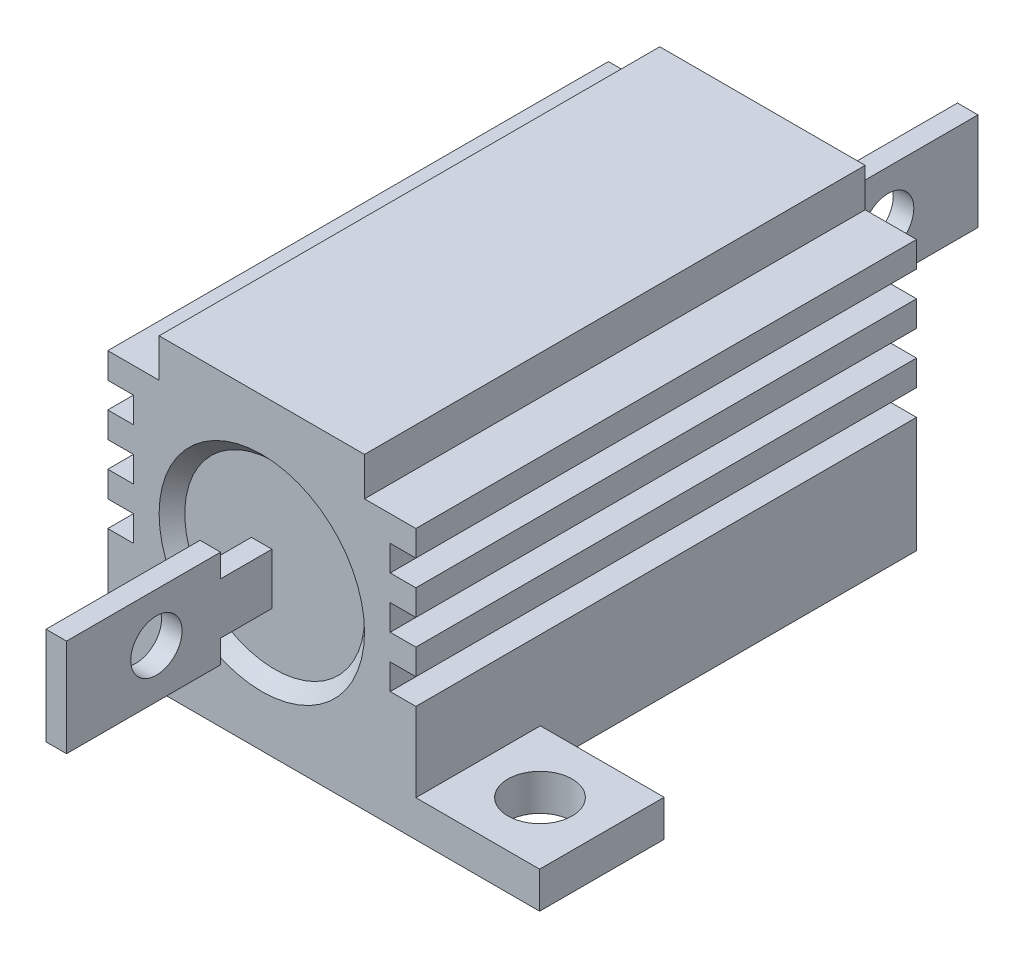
SolidWorks part; units mm, degrees
ref_plane "Plan de face" through (0, 0, 0) normal (0, 0, 1) x (1, 0, 0)
ref_plane "Plan de dessus" through (0, 0, 0) normal (0, 1, 0) x (1, 0, 0)
ref_plane "Plan de droite" through (0, 0, 0) normal (1, 0, 0) x (0, 0, -1)
sketch "Esquisse1" plane through (0, 0, 0) normal (0, 0, 1) x (1, 0, 0)
  line L0 (-10.4943, 0) -> (-22.4943, 0)
  line L1 (-22.4943, 0) -> (-22.4943, 4.5)
  line L2 (-22.4943, 4.5) -> (-21.4943, 4.5)
  line L3 (-21.4943, 4.5) -> (-21.4943, 5.5)
  line L4 (-21.4943, 5.5) -> (-22.4943, 5.5)
  line L5 (-22.4943, 5.5) -> (-22.4943, 6.5)
  line L6 (-22.4943, 6.5) -> (-21.4943, 6.5)
  line L7 (-21.4943, 6.5) -> (-21.4943, 7.5)
  line L8 (-21.4943, 7.5) -> (-22.4943, 7.5)
  line L9 (-22.4943, 7.5) -> (-22.4943, 8.5)
  line L10 (-22.4943, 8.5) -> (-21.4943, 8.5)
  line L11 (-21.4943, 8.5) -> (-21.4943, 9.5)
  line L12 (-21.4943, 9.5) -> (-22.4943, 9.5)
  line L13 (-22.4943, 9.5) -> (-22.4943, 10.5)
  line L14 (-22.4943, 10.5) -> (-20.4943, 10.5)
  line L15 (-20.4943, 10.5) -> (-20.4943, 12)
  line L16 (-20.4943, 12) -> (-12.4943, 12)
  line L18 (-12.4943, 10.5) -> (-12.4943, 12)
  line L19 (-10.4943, 10.5) -> (-12.4943, 10.5)
  line L20 (-10.4943, 9.5) -> (-10.4943, 10.5)
  line L21 (-11.4943, 9.5) -> (-10.4943, 9.5)
  line L22 (-11.4943, 8.5) -> (-11.4943, 9.5)
  line L23 (-10.4943, 8.5) -> (-11.4943, 8.5)
  line L24 (-10.4943, 7.5) -> (-10.4943, 8.5)
  line L25 (-11.4943, 7.5) -> (-10.4943, 7.5)
  line L26 (-11.4943, 6.5) -> (-11.4943, 7.5)
  line L27 (-10.4943, 6.5) -> (-11.4943, 6.5)
  line L28 (-10.4943, 5.5) -> (-10.4943, 6.5)
  line L29 (-11.4943, 5.5) -> (-10.4943, 5.5)
  line L30 (-11.4943, 4.5) -> (-11.4943, 5.5)
  line L31 (-10.4943, 4.5) -> (-11.4943, 4.5)
  line L32 (-10.4943, 0) -> (-10.4943, 4.5)
  dimension "D3" = 1.5
  dimension "D4" = 1
  dimension "D5" = 1
  dimension "D6" = 1
  dimension "D7" = 1
  dimension "D8" = 1
  dimension "D9" = 1
  dimension "D10" = 12
  dimension "D11" = 1
  dimension "D12" = 1
  dimension "D13" = 1
extrude "Boss.-Extru.1" add sketch "Esquisse1" along normal blind 19.5
sketch "Esquisse2" plane through (-10.4943, 0, 0) normal (1, 0, 0) x (0, 0, -1)
  line L1 (-19.5, 0) -> (-14.65, 0)
  line L2 (-19.5, 0) -> (-19.5, 1.42)
  line L3 (-19.5, 1.42) -> (-14.65, 1.42)
  line L4 (-14.65, 0) -> (-14.65, 1.42)
  dimension "D1" = 1.42
  dimension "D2" = 4.85
extrude "Boss.-Extru.2" add sketch "Esquisse2" along normal blind 4.82
sketch "Esquisse3" plane through (-22.4943, 0, 0) normal (-1, 0, 0) x (0, 0, 1)
  line L1 (0, 0) -> (4.82, 0)
  line L2 (0, 0) -> (0, 1.42)
  line L3 (0, 1.42) -> (4.82, 1.42)
  line L4 (4.82, 0) -> (4.82, 1.42)
  dimension "D1" = 4.82
  dimension "D2" = 1.42
extrude "Boss.-Extru.3" add sketch "Esquisse3" along normal blind 4.82
sketch "Esquisse4" plane through (0, 1.42, 0) normal (0, 1, 0) x (1, 0, 0)
  line L0 (-27.3143, 0) -> (-22.4943, -4.82) construction
  line L1 (-5.6743, -14.65) -> (-10.4943, -19.5) construction
  circle A0 centre (-24.9043, -2.41) radius 1.25
  circle A1 centre (-8.0843, -17.075) radius 1.25
extrude "Enlèv. mat.-Extru.1" cut sketch "Esquisse4" against normal blind 4.82
sketch "Esquisse5" plane through (0, 0, 19.5) normal (0, 0, 1) x (1, 0, 0)
  line L0 (-16.4943, 12) -> (-16.4943, 0) construction
  line L1 (-12.4943, 12) -> (-20.4943, 12) construction
  line L2 (-22.4943, 0) -> (-5.6743, 0) construction
  circle A0 centre (-16.4943, 6) radius 3.5
extrude "Enlèv. mat.-Extru.2" cut sketch "Esquisse5" against normal blind 0.5
chamfer "Chanfrein1" distance 0.5 angle 45 1 edges at (-12.9943, 6, 19.5)
sketch "Esquisse6" plane through (0, 0, 0) normal (0, 0, -1) x (-1, 0, 0)
  line L0 (16.4943, 12) -> (16.4943, 0) construction
  line L1 (12.4943, 12) -> (20.4943, 12) construction
  line L2 (27.3143, 0) -> (10.4943, 0) construction
  circle A0 centre (16.4943, 6) radius 3.5
extrude "Enlèv. mat.-Extru.3" cut sketch "Esquisse6" against normal blind 0.5
chamfer "Chanfrein2" distance 0.5 angle 45 1 edges at (-19.9943, 6, 0)
ref_plane "Plan1" through (-16.5, 0, 0) normal (1, 0, 0) x (0, 0, -1)
sketch "Esquisse7" plane through (-16.5, 0, 0) normal (1, 0, 0) x (0, 0, -1)
  line L0 (8.8118, 6) -> (-3.875, 6) construction
  line L1 (-9.75, 16.6953) -> (-9.75, 10.5) construction
  line L2 (-19.5, 10.5) -> (0, 10.5) construction
  line L3 (8, 12.4414) -> (8, 5.3598) construction
  line L4 (2.611, 7) -> (-0.3076, 7) construction
  line L5 (2, 9.7031) -> (2, 5.3598) construction
  line L6 (0, 10.5) -> (0, 12) construction
  line L7 (8.6479, 7.9) -> (1.5457, 7.9) construction
  line L8 (0, 7) -> (2, 7)
  line L9 (2, 7) -> (2, 7.9)
  line L10 (2, 7.9) -> (8, 7.9)
  line L11 (2, 4.1) -> (8, 4.1)
  line L12 (2, 5) -> (2, 4.1)
  line L13 (0, 5) -> (2, 5)
  line L14 (0, 7) -> (0, 5)
  line L15 (8, 7.9) -> (8, 4.1)
  line L16 (-21.5, 7.9) -> (-27.5, 7.9)
  line L17 (-21.5, 7) -> (-21.5, 7.9)
  line L18 (-19.5, 7) -> (-21.5, 7)
  line L19 (-19.5, 7) -> (-19.5, 5)
  line L20 (-19.5, 5) -> (-21.5, 5)
  line L21 (-21.5, 5) -> (-21.5, 4.1)
  line L22 (-21.5, 4.1) -> (-27.5, 4.1)
  line L23 (-27.5, 7.9) -> (-27.5, 4.1)
  circle A0 centre (4.5, 6) radius 1
  circle A1 centre (-24, 6) radius 1
  dimension "D1" = 8
  dimension "D2" = 6
  dimension "D3" = 1.9
  dimension "D4" = 1
  dimension "D5" = 3.5
extrude "Boss.-Extru.4" add sketch "Esquisse7" along normal mid plane 0.8 separate body
